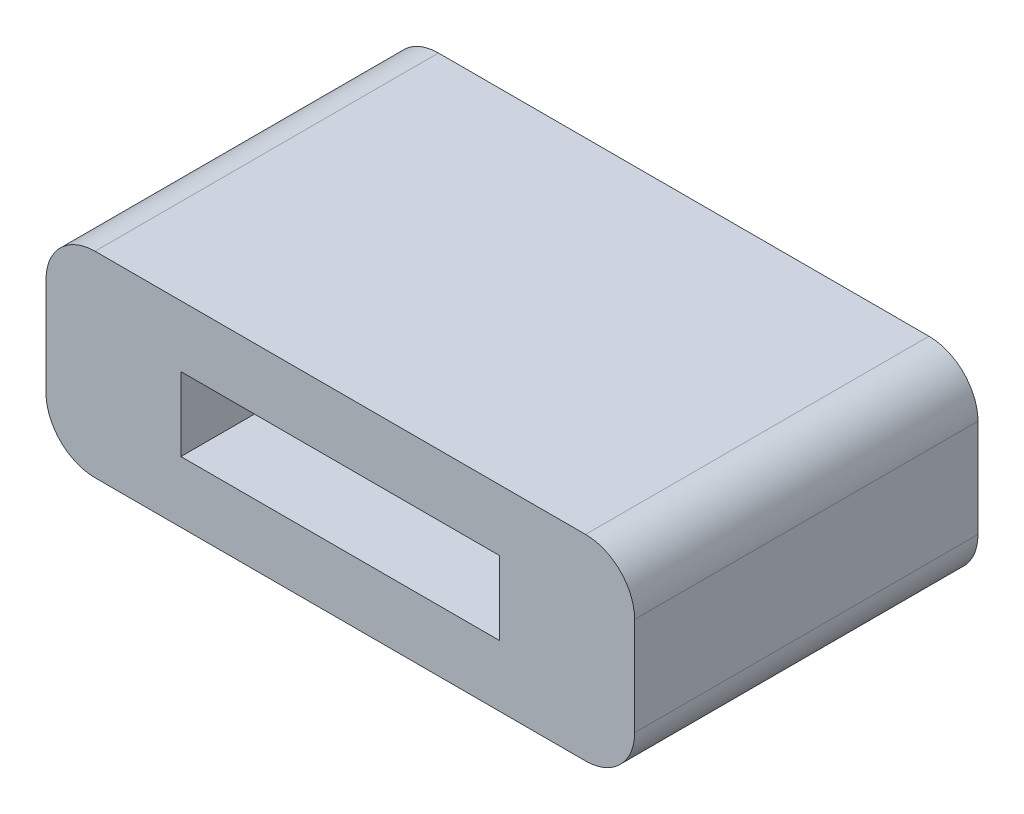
SolidWorks part; units mm, degrees
ref_plane "Plan de face" through (0, 0, 0) normal (0, 0, 1) x (1, 0, 0)
ref_plane "Plan de dessus" through (0, 0, 0) normal (0, 1, 0) x (1, 0, 0)
ref_plane "Plan de droite" through (0, 0, 0) normal (1, 0, 0) x (0, 0, -1)
sketch "Esquisse1" plane through (0, 0, 0) normal (0, 0, 1) x (1, 0, 0)
  line L1 (-5, 2) -> (5, 2)
  line L2 (-6, 1) -> (-6, -1)
  line L3 (-5, -2) -> (5, -2)
  line L4 (6, 1) -> (6, -1)
  arc A0 (-5, 2) -> (-6, 1) centre (-5, 1) ccw
  arc A1 (5, 2) -> (6, 1) centre (5, 1) cw
  arc A2 (5, -2) -> (6, -1) centre (5, -1) ccw
  arc A3 (-6, -1) -> (-5, -2) centre (-5, -1) ccw
  point P7 (-6, 2)
  point P10 (6, 2)
  point P13 (6, -2)
  dimension "D5" = 1
  dimension "D1" = 12
  dimension "D2" = 6
  dimension "D3" = 4
  dimension "D4" = 2
extrude "Extrusion1" add sketch "Esquisse1" against normal blind 7
sketch "Esquisse2" plane through (0, 0, 0) normal (0, 0, 1) x (1, 0, 0)
  line L0 (5, 2) -> (-5, 2) construction
  line L12 (-3.25, 0.75) -> (-3.25, -0.75)
  line L13 (-3.25, -0.75) -> (3.25, -0.75)
  line L14 (3.25, -0.75) -> (3.25, 0.75)
  line L15 (3.25, 0.75) -> (-3.25, 0.75)
  dimension "D1" = 6.5
  dimension "D2" = 1.25
  dimension "D3" = 1.5
  dimension "D4" = 3.25
extrude "Enlèv. mat.-Extru.1" cut sketch "Esquisse2" against normal blind 4
sketch "Esquisse3" plane through (0, 0, -7) normal (0, 0, -1) x (-1, 0, 0)
  line L0 (3.25, 0.75) -> (3.25, -0.75) construction
  line L1 (3.25, -0.75) -> (-3.25, -0.75) construction
  line L2 (-3.25, -0.75) -> (-3.25, 0.75) construction
  line L3 (-3.25, 0.75) -> (3.25, 0.75) construction
  line L4 (3.25, 0.75) -> (3.25, -0.75)
  line L5 (3.25, -0.75) -> (-3.25, -0.75)
  line L6 (-3.25, -0.75) -> (-3.25, 0.75)
  line L7 (-3.25, 0.75) -> (3.25, 0.75)
extrude "Extrusion2" add sketch "Esquisse3" along normal blind 1 draft 45
